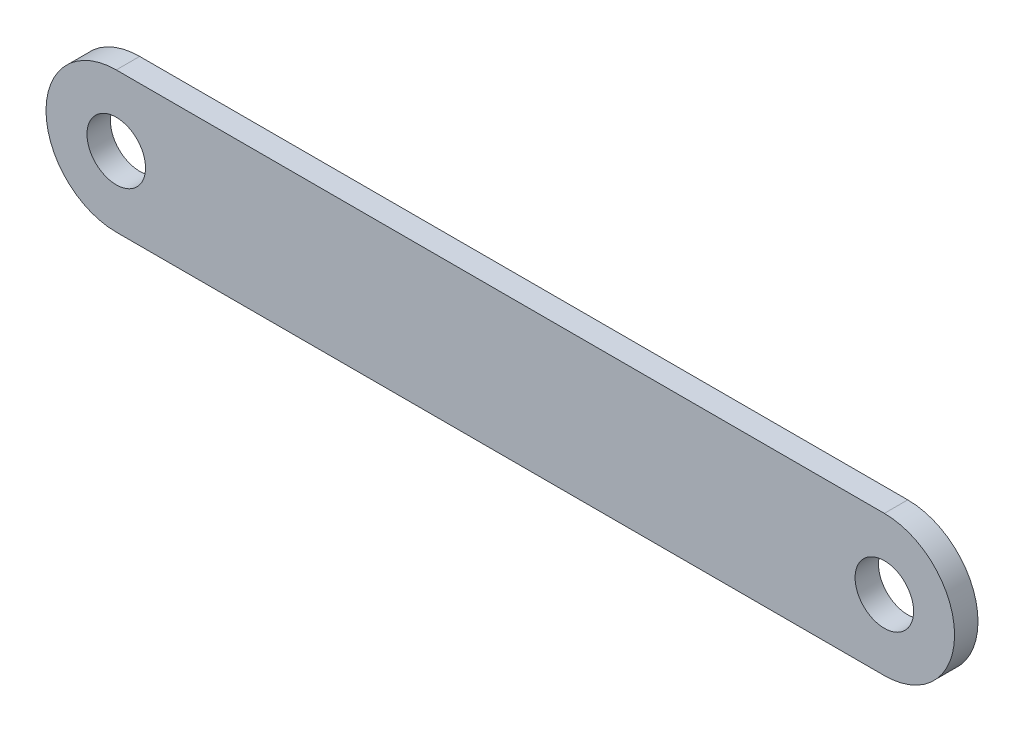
SolidWorks part; units mm, degrees
other "<Left_LongArm>-<Extrude1>"
ref_plane "Front Plane" through (0, 0, 0) normal (0, 0, 1) x (1, 0, 0)
ref_plane "Top Plane" through (0, 0, 0) normal (0, 1, 0) x (1, 0, 0)
ref_plane "Right Plane" through (0, 0, 0) normal (1, 0, 0) x (0, 0, -1)
mirrored part "Left_LongArm_Mirrored"
ref_point "Point1"
ref_point "Point2"
ref_point "Point3"
ref_point "Point4"
